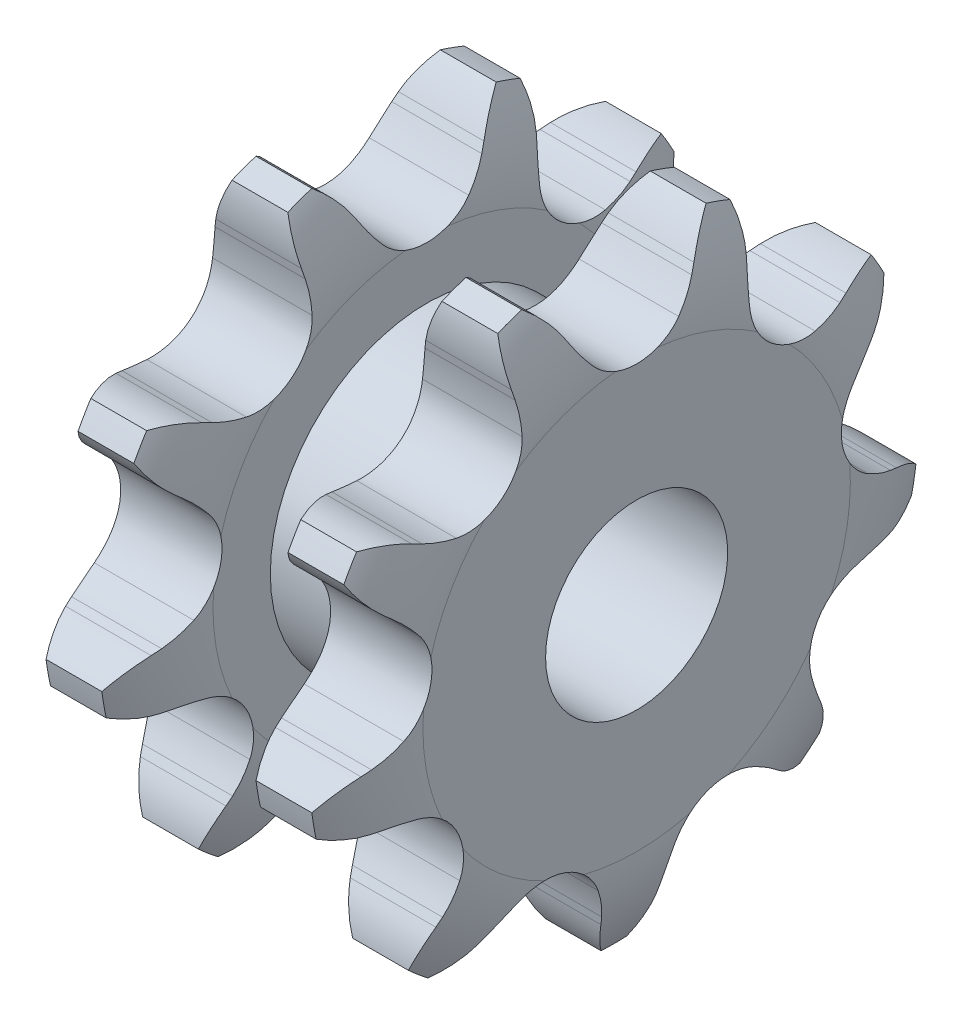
SolidWorks part; units mm, degrees
ref_plane "Plane1" through (0, 0, 0) normal (0, 0, 1) x (1, 0, 0)
ref_plane "Plane2" through (0, 0, 0) normal (0, 1, 0) x (1, 0, 0)
ref_plane "Plane3" through (0, 0, 0) normal (1, 0, 0) x (0, 0, -1)
other "Configuration Table"
sketch "Clipboard" plane through (0, 0, 0) normal (0, 1, 0) x (1, 0, 0)
  line L0 (0, 0) -> (25.0873, -3.9734)
  line L1 (-15, 0) -> (100, 0) construction
  line L2 (0, 0) -> (-2.1039, 2.3779)
  line L3 (0, 0) -> (-11.863, 4.5341)
  line L4 (0, 0) -> (15.6796, 2.4834)
  line L5 (0, 0) -> (-47.5972, -17.7524)
  line L6 (0, 0) -> (-35.9946, -24.2857)
  line L7 (-2.1039, 2.3779) -> (47.7628, 12.071)
  line L8 (-76.2, 38.1) -> (-47.9044, 38.1)
  line L9 (-73.2054, 38.5461) -> (-73.0531, 38.5485)
  line L10 (-73.0533, 76.1892) -> (-43.7671, 76.1892)
  circle A0 centre (0, 0) radius 7.9375
  circle A1 centre (0, 0) radius 21.812
  circle A2 centre (0, 0) radius 25.4
sketch "BasProSke" plane through (0, 0, 0) normal (0, 1, 0) x (1, 0, 0)
  line L0 (-10, 0) -> (60, 0) construction
  line L1 (0, 0) -> (0, 29.813)
  line L2 (0, 0) -> (43.4213, 0)
  line L3 (43.4213, 0) -> (43.4213, 29.813)
  line L4 (40.2463, 42.513) -> (3.175, 42.513)
  arc A0 (0, 29.813) -> (3.175, 42.513) centre (26.9875, 29.813) cw
  arc A1 (43.4213, 29.813) -> (40.2463, 42.513) centre (16.4338, 29.813) ccw
revolve "Base-Revolve" add sketch "BasProSke" angle 360 about L0
sketch "GrvSke" plane through (0, 0, 0) normal (0, 1, 0) x (1, 0, 0)
  line L0 (14.1351, 29.813) -> (14.1351, 21.812)
  line L1 (14.1351, 21.812) -> (29.2862, 21.812)
  line L2 (29.2862, 21.812) -> (29.2862, 29.813)
  line L3 (10.9601, 42.513) -> (32.4612, 42.513)
  line L4 (21.7106, 0) -> (21.7106, 52.07) construction
  line L5 (-10, 0) -> (60, 0) construction
  line L6 (0, 0) -> (35.56, 0) construction
  arc A0 (29.2862, 29.813) -> (32.4612, 42.513) centre (56.2737, 29.813) cw
  arc A1 (14.1351, 29.813) -> (10.9601, 42.513) centre (-12.8524, 29.813) ccw
revolve "Groove" cut sketch "GrvSke" angle 360 about L6
pattern_linear "Grooves" [suppressed]
sketch "TooCutSke" plane through (0, 0, 0) normal (1, 0, 0) x (0, 0, -1)
  line L0 (8.4728, 35.2524) -> (9.083, 36.3141)
  line L1 (0, 0) -> (0, 107) construction
  line L2 (0, 37.1323) -> (-10, 37.1323) construction
  line L3 (-8.4728, 35.2524) -> (-9.083, 36.3141)
  arc A0 (5.9876, 31.8038) -> (8.4728, 35.2524) centre (-9.4872, 45.5752) ccw
  arc A1 (5.9876, 31.8038) -> (-5.9876, 31.8038) centre (0, 37.1323) cw
  arc A2 (9.083, 36.3141) -> (20.8847, 43.143) centre (20.8847, 29.5309) cw
  arc A3 (-5.9876, 31.8038) -> (-8.4728, 35.2524) centre (9.4872, 45.5752) cw
  arc A4 (-9.083, 36.3141) -> (-20.8847, 43.143) centre (-20.8847, 29.5309) ccw
  arc A5 (20.8847, 43.143) -> (-20.8847, 43.143) centre (0, 0) ccw
extrude "ToothCut" cut sketch "TooCutSke" along normal through all
pattern_circular "TeethCuts" count 9 every 40 about axis through (-10, 0, 0) along (1, 0, 0) of "ToothCut"
sketch "HubNeaOneSke" plane through (0, 0, 0) normal (-1, 0, 0) x (0, 0, 1)
  circle A0 centre (0, 0) radius 21.812
extrude "HubNearOne" [suppressed] add sketch "HubNeaOneSke" along normal blind 7.3788
sketch "HubNeaBotSke" plane through (0, 0, 0) normal (-1, 0, 0) x (0, 0, 1)
  circle A0 centre (0, 0) radius 21.812
extrude "HubNearBoth" [suppressed] add sketch "HubNeaBotSke" along normal blind 3.6894
ref_plane "FarPln" through (43.4213, 0, 0) normal (1, 0, 0) x (0, 0, -1)
sketch "HubFarSke" plane through (43.4213, 0, 0) normal (1, 0, 0) x (0, 0, -1)
  circle A0 centre (0, 0) radius 21.812
extrude "HubFar" [suppressed] add sketch "HubFarSke" along normal blind 3.6894
sketch "BorSke" plane through (0, 0, 0) normal (1, 0, 0) x (0, 0, -1)
  circle A0 centre (0, 0) radius 12.7
extrude "Bore" cut sketch "BorSke" along normal mid plane 101.6001
sketch "KeySke" plane through (0, 0, 0) normal (1, 0, 0) x (0, 0, -1)
  line L0 (-3.175, 0) -> (-3.175, 15.5956)
  line L1 (-3.175, 15.5956) -> (3.175, 15.5956)
  line L2 (3.175, 15.5956) -> (3.175, 0)
  line L3 (0, 0) -> (0, 34) construction
  line L4 (-3.175, 0) -> (3.175, 0)
extrude "Keyway" [suppressed] cut sketch "KeySke" along normal mid plane 101.6001
pattern_circular "Keyway2" [suppressed] count 2 every 90 about axis through (-10, 0, 0) along (1, 0, 0)
equation "\"Num_teeth@Clipboard\" = int( \"Num_teeth@Clipboard\" )"
equation "\"Num_teeth@Clipboard\" = ((sgn( \"Num_teeth@Clipboard\" - 5.0)+1)*( \"Num_teeth@Clipboard\" - 5.0))/2 +5.0"
equation "\"Num_teeth@Clipboard\" = ((sgn( \"Num_teeth@Clipboard\" - 200.0)-1)*( \"Num_teeth@Clipboard\" - 200.0))/-2 +200.0"
equation "\"MHD@Clipboard\" = \"Pitch@Clipboard\" * (1.0 / tan(3.14159265 / \"Num_teeth@Clipboard\" ) - 1.0) - 0.03"
equation "\"Thickness@Clipboard\"  = \"Width@Clipboard\" * \"Width_factor@Clipboard\" - \"Width_const@Clipboard\" + (\"Num_strands@Clipboard\" - 1) * \"Transv_pitch@Clipboard\""
equation "\"OAL@Clipboard\" = \"Thickness@Clipboard\""
equation "\"MHD@Clipboard\" = ((sgn( \"MHD@Clipboard\" - \"Hub_dia@Clipboard\" )-1)*( \"MHD@Clipboard\" - \"Hub_dia@Clipboard\" ))/-2+ \"Hub_dia@Clipboard\""
equation "\"OAL@Clipboard\" = ((sgn( \"OAL@Clipboard\" - \"Overall_len@Clipboard\" )+1)*( \"OAL@Clipboard\" - \"Overall_len@Clipboard\" ))/2 + \"Overall_len@Clipboard\" + 0.000002"
equation "\"Num_teeth@TeethCuts\" = int( \"Show_teeth@Clipboard\" ) + 1"
equation "\"Num_teeth@TeethCuts\" = ((sgn( \"Num_teeth@TeethCuts\" - \"Num_teeth@Clipboard\" )-1)*( \"Num_teeth@TeethCuts\" - \"Num_teeth@Clipboard\" ))/-2+ \"Num_teeth@Clipboard\""
equation "\"Num_teeth@TeethCuts\" = ((sgn( \"Num_teeth@TeethCuts\" - 2.0)+1)*( \"Num_teeth@TeethCuts\" - 2.0))/2 +2.0"
equation "\"Angle@TeethCuts\" = 360.0 / \"Num_teeth@Clipboard\""
equation "\"Pitch_radius@TooCutSke\" = ( \"Pitch@Clipboard\" / 2.0) / sin(3.14159265 / \"Num_teeth@Clipboard\" )  'ma"
equation "\"R@TooCutSke\"  = \"Dr@Clipboard\" * 0.5025 + 0.0015"
equation "\"A@TooCutSke\" = 35.0 + (60.0 / \"Num_teeth@Clipboard\")"
equation "\"E@TooCutSke\"  = \"Dr@Clipboard\" * 1.3025 + 0.0015"
equation "\"B@TooCutSke\"  = 18.0 - (56.0 / \"Num_teeth@Clipboard\" )"
equation "\"W@TooCutSke\" = 1.4 * \"Dr@Clipboard\" * cos(3.14159265 / \"Num_teeth@Clipboard\" )"
equation "\"V@TooCutSke\" = 1.4 * \"Dr@Clipboard\" * sin(3.14159265 / \"Num_teeth@Clipboard\" )"
equation "\"Diameter@BasProSke\" = 2.0 * ( (0.3 * \"Pitch@Clipboard\" ) +  \"Pitch@Clipboard\" / 2.0 / tan(3.14159265 / \"Num_teeth@Clipboard\" ))"
equation "\"Thickness@BasProSke\"  = \"Thickness@Clipboard\""
equation "\"G1@BasProSke\" =  \"Chamfer_wid@Clipboard\""
equation "\"G2@BasProSke\" =  \"Chamfer_wid@Clipboard\""
equation "\"H1@BasProSke\" =  \"Chamfer_dep@Clipboard\""
equation "\"H2@BasProSke\" =  \"Chamfer_dep@Clipboard\""
equation "\"Diameter@GrvSke\" = \"Diameter@BasProSke\""
equation "\"G1@GrvSke\" = \"Chamfer_wid@Clipboard\""
equation "\"H1@GrvSke\" = \"Chamfer_dep@Clipboard\""
equation "\"Grv_diam@GrvSke\" =  \"Pitch@Clipboard\" * (1.0 / tan(3.14159265 / \"Num_teeth@Clipboard\" ) - 1.0) - 0.03"
equation "\"Grv_width@GrvSke\" =  \"Transv_pitch@Clipboard\" - ( \"Width@Clipboard\" * \"Width_factor@Clipboard\" - \"Width_const@Clipboard\" )"
equation "\"Offset@GrvSke\" = \"Grv_width@GrvSke\" / 2.0 + ( \"Width@Clipboard\" * \"Width_factor@Clipboard\" - \"Width_const@Clipboard\" )"
equation "\"Offset@Grooves\" = \"Transv_pitch@Clipboard\""
equation "\"Num_grvs@Grooves\" = \"Num_strands@Clipboard\""
equation "\"Num_grvs@Grooves\" = \"Num_grvs@Grooves\" - 1 * sgn( \"Num_grvs@Grooves\" -1)"
equation "\"Diameter@HubNeaOneSke\" = \"MHD@Clipboard\""
equation "\"Length@HubNearOne\" = \"OAL@Clipboard\" - \"Thickness@BasProSke\""
equation "\"Diameter@HubNeaBotSke\" = \"MHD@Clipboard\""
equation "\"Length@HubNearBoth\" = ( \"OAL@Clipboard\" - \"Thickness@BasProSke\" ) / 2.0"
equation "\"Thickness@FarPln\" = \"Thickness@BasProSke\""
equation "\"Diameter@HubFarSke\" = \"MHD@Clipboard\""
equation "\"Length@HubFar\" = ( \"OAL@Clipboard\" - \"Thickness@BasProSke\" ) / 2.0"
equation "\"D1@Bore\" = \"OAL@Clipboard\" * 2.0"
equation "\"D1@Keyway\" = \"OAL@Clipboard\" * 2.0"
equation "\"Offset@KeySke\" = \"T_dim@Clipboard\" - \"Diameter@BorSke\" / 2.0"
